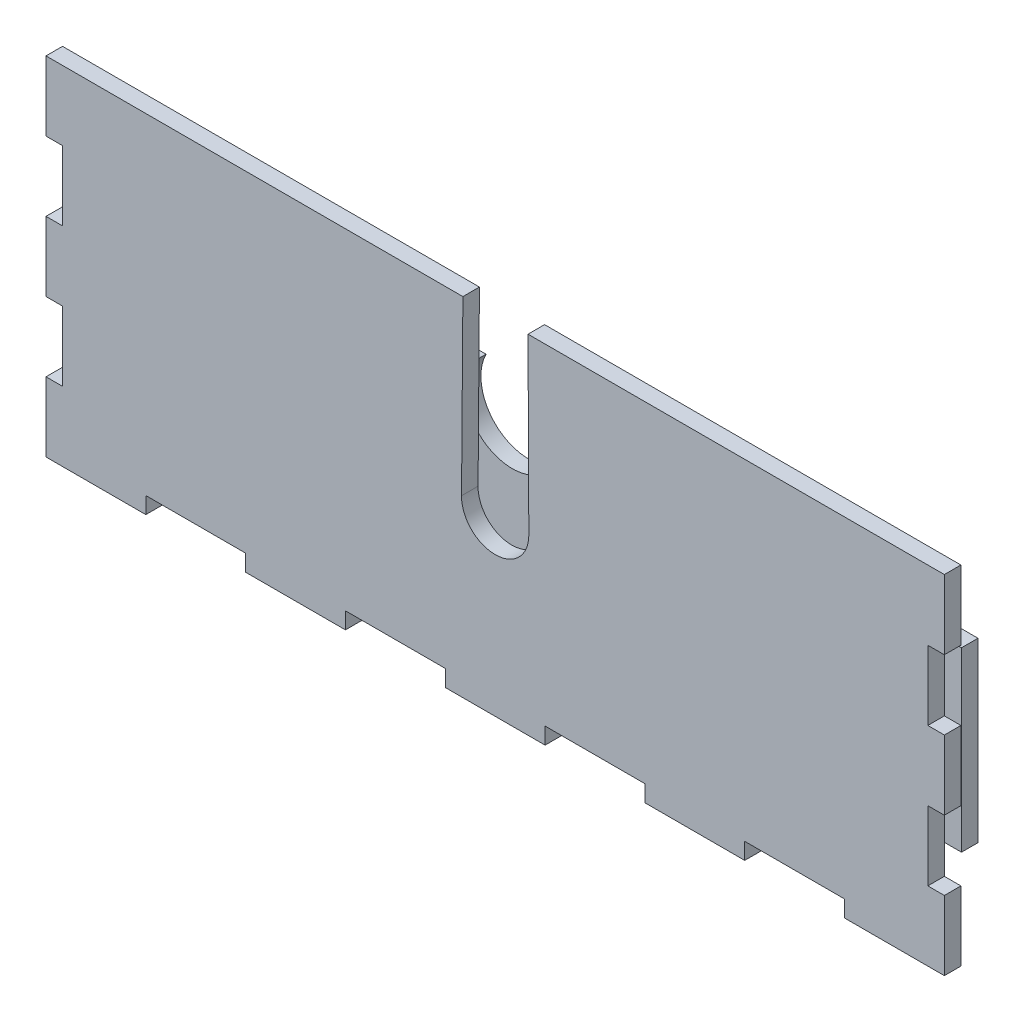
SolidWorks part; units mm, degrees
ref_plane "Front Plane" through (0, 0, 0) normal (0, 0, 1) x (1, 0, 0)
ref_plane "Top Plane" through (0, 0, 0) normal (0, 1, 0) x (1, 0, 0)
ref_plane "Right Plane" through (0, 0, 0) normal (1, 0, 0) x (0, 0, -1)
sketch "Sketch2" plane through (0, 0, 0) normal (0, 0, 1) x (1, 0, 0)
  line L0 (187.4231, 0) -> (0, 0)
  line L1 (226.7931, 0) -> (414.02, 0)
  line L2 (0, 0) -> (0, -81.548)
  line L3 (414.02, 0) -> (414.02, -81.548)
  line L4 (414.02, -81.548) -> (0, -81.548)
  arc A0 (226.7931, 0) -> (187.4231, 0) centre (207.1081, -9.9454) cw
  dimension "D1" = 414.02
  dimension "D2" = 81.548
  dimension "D3" = 39.37
extrude "Boss-Extrude1" add sketch "Sketch2" along normal blind 7.62
sketch "Sketch5" plane through (0, 0, 7.62) normal (0, 0, 1) x (1, 0, 0)
  line L0 (0, 32.8964) -> (192.01, 32.8964)
  line L1 (222.01, 32.8964) -> (413.7613, 32.8964)
  line L2 (0, 32.8964) -> (0, 0.8964)
  line L3 (413.7613, 32.8964) -> (413.7613, 0.8964)
  line L4 (413.7613, 0.8964) -> (406.146, 0.8964)
  line L5 (0, 0.8964) -> (7.62, 0.8964)
  line L6 (7.62, 0.8964) -> (7.62, -31.1036)
  line L7 (7.62, -31.1036) -> (0, -31.1036)
  line L8 (0, -31.1036) -> (0, -63.1036)
  line L9 (0, -63.1036) -> (7.62, -63.1036)
  line L10 (7.62, -63.1036) -> (7.62, -95.1036)
  line L11 (7.62, -95.1036) -> (0, -95.1036)
  line L12 (0, -95.1036) -> (0, -127.1036)
  line L13 (406.146, 0.8964) -> (406.146, -31.1036)
  line L14 (406.146, -31.1036) -> (413.766, -31.1036)
  line L15 (413.766, -31.1036) -> (413.766, -63.1036)
  line L16 (413.766, -63.1036) -> (406.146, -63.1036)
  line L17 (406.146, -63.1036) -> (406.146, -95.1036)
  line L18 (406.146, -95.1036) -> (413.766, -95.1036)
  line L19 (413.766, -95.1036) -> (413.766, -127.1036)
  line L20 (413.766, -127.1036) -> (367.792, -127.1036)
  line L21 (367.792, -127.1036) -> (367.792, -119.4836)
  line L22 (367.792, -119.4836) -> (321.818, -119.4836)
  line L23 (321.818, -119.4836) -> (321.818, -127.1036)
  line L24 (321.818, -127.1036) -> (275.844, -127.1036)
  line L25 (275.844, -127.1036) -> (275.844, -119.4836)
  line L26 (275.844, -119.4836) -> (229.87, -119.4836)
  line L27 (229.87, -119.4836) -> (229.87, -127.1036)
  line L28 (229.87, -127.1036) -> (183.896, -127.1036)
  line L29 (183.896, -127.1036) -> (183.896, -119.4836)
  line L30 (183.896, -119.4836) -> (137.922, -119.4836)
  line L31 (137.922, -119.4836) -> (137.922, -127.1036)
  line L32 (137.922, -127.1036) -> (91.948, -127.1036)
  line L33 (91.948, -127.1036) -> (91.948, -119.4836)
  line L34 (91.948, -119.4836) -> (45.974, -119.4836)
  line L35 (45.974, -119.4836) -> (45.974, -127.1036)
  line L36 (45.974, -127.1036) -> (0, -127.1036)
  line L37 (222.01, 32.8964) -> (222.3823, -46.9591)
  line L38 (192.01, 32.8964) -> (191.3849, -46.8607)
  arc A0 (191.3849, -46.8607) -> (222.3823, -46.9591) centre (206.883, -47.1036) ccw
  dimension "D22" = 7.62
  dimension "D3" = 32
  dimension "D4" = 32
  dimension "D5" = 32
  dimension "D6" = 32
  dimension "D7" = 32
  dimension "D8" = 32
  dimension "D9" = 32
  dimension "D10" = 32
  dimension "D11" = 32
  dimension "D12" = 32
  dimension "D13" = 45.974
  dimension "D14" = 45.974
  dimension "D15" = 45.974
  dimension "D16" = 45.974
  dimension "D17" = 45.974
  dimension "D18" = 45.974
  dimension "D19" = 45.974
  dimension "D20" = 45.974
  dimension "D21" = 45.974
  dimension "D24" = 7.62
  dimension "D25" = 7.62
  dimension "D26" = 7.6153
  dimension "D27" = 7.62
  dimension "D28" = 7.62
  dimension "D29" = 7.62
extrude "Boss-Extrude5" add sketch "Sketch5" along normal blind 7.62 separate body
